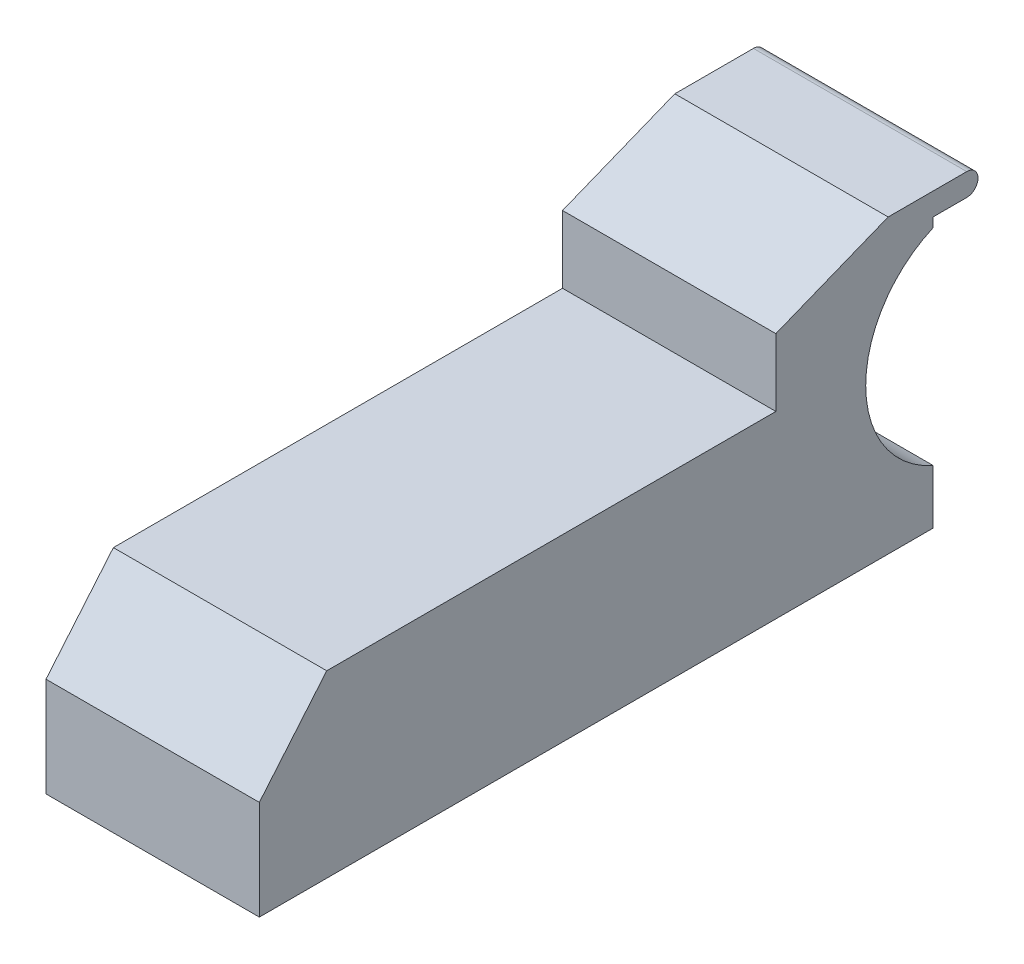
SolidWorks part; units mm, degrees
ref_plane "前视基准面" through (0, 0, 0) normal (0, 0, 1) x (1, 0, 0)
ref_plane "上视基准面" through (0, 0, 0) normal (0, 1, 0) x (1, 0, 0)
ref_plane "右视基准面" through (0, 0, 0) normal (1, 0, 0) x (0, 0, -1)
sketch "草图1" plane through (0, 0, 0) normal (0, 0, 1) x (1, 0, 0)
  line L0 (0, 0) -> (9.5, 0)
  line L1 (0, 13) -> (9.5, 13)
  line L2 (0, 0) -> (0, 13)
  line L3 (9.5, 0) -> (9.5, 13)
extrude "凸台-拉伸1" add sketch "草图1" along normal blind 32
sketch "草图2" plane through (9.5, 0, 0) normal (1, 0, 0) x (0, 0, -1)
  line L0 (-2, 12) -> (-0.5, 12)
  line L1 (-32, 0) -> (-2, 0)
  line L2 (-4, 13) -> (-0.5, 13)
  line L3 (-32, 0) -> (-32, 4.4247)
  line L4 (-29, 8) -> (-9, 8)
  line L5 (-9, 8) -> (-9, 11)
  line L6 (-4, 13) -> (-9, 11)
  line L7 (-2, 0) -> (-2, 2.4174)
  line L8 (-2, 11.5826) -> (-2, 12)
  line L9 (-32, 4.4247) -> (-29, 8)
  arc A0 (-0.5, 12) -> (-0.5, 13) centre (-0.5, 12.5) ccw
  arc A1 (-2, 11.5826) -> (-2, 2.4174) centre (0, 7) ccw
extrude "切除-拉伸1" cut sketch "草图2" against normal blind 32 flip side to cut
sketch "草图3" plane through (0, 8, 0) normal (0, 1, 0) x (1, 0, 0)
  line L0 (2.75, -26.5) -> (2.75, -10.5) construction
  line L1 (6.75, -26.5) -> (6.75, -10.5) construction
  arc A0 (2.75, -26.5) -> (6.75, -26.5) centre (4.75, -26.5) ccw construction
  arc A1 (6.75, -10.5) -> (2.75, -10.5) centre (4.75, -10.5) ccw construction
sketch "草图4" plane through (0, 0, 0) normal (0, -1, 0) x (1, 0, 0)
  line L0 (4.75, 26.5) -> (4.75, 10.5) construction
  line L1 (6.7608, 26.5) -> (6.7608, 10.5)
  line L2 (2.7392, 26.5) -> (2.7392, 10.5)
  arc A0 (6.7608, 26.5) -> (2.7392, 26.5) centre (4.75, 26.5) ccw
  arc A1 (2.7392, 10.5) -> (6.7608, 10.5) centre (4.75, 10.5) ccw
  point P4 (4.75, 18.5)
extrude "切除-拉伸2" cut sketch "草图4" against normal blind 4
